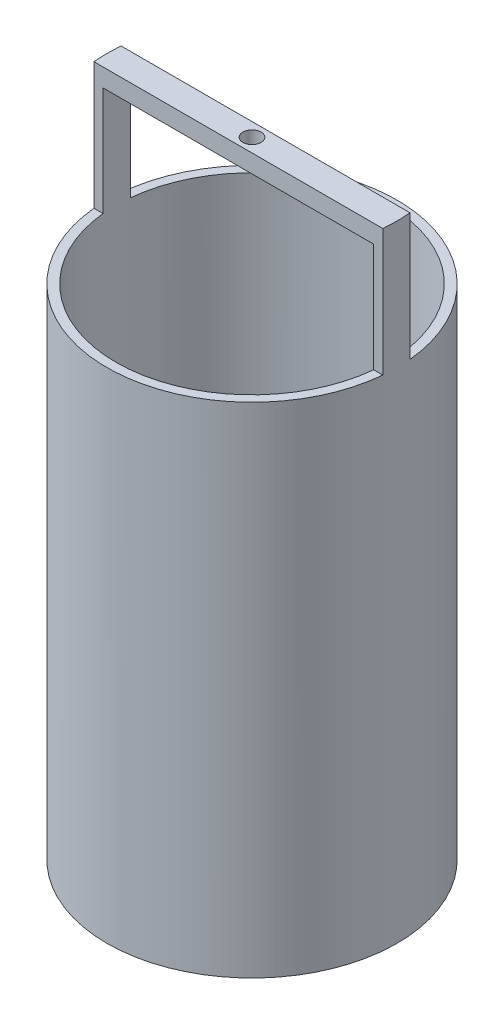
SolidWorks part; units mm, degrees
ref_plane "Front Plane" through (0, 0, 0) normal (0, 0, 1) x (1, 0, 0)
ref_plane "Top Plane" through (0, 0, 0) normal (0, 1, 0) x (1, 0, 0)
ref_plane "Right Plane" through (0, 0, 0) normal (1, 0, 0) x (0, 0, -1)
sketch "Sketch1" plane through (0, 0, 0) normal (0, 1, 0) x (1, 0, 0)
  circle A0 centre (0, 0) radius 160
  circle A1 centre (0, 0) radius 150
  dimension "D1" = 300
  dimension "D2" = 320
extrude "Boss-Extrude1" add sketch "Sketch1" along normal blind 550
sketch "Sketch2" plane through (0, 550, 0) normal (0, 1, 0) x (1, 0, 0)
  line L0 (0, -15) -> (0, 15) construction
  line L2 (0, -55) -> (0, 55) construction
  line L3 (-159.2953, 15) -> (-149.2481, 15)
  line L4 (-159.2953, -15) -> (-149.2481, -15)
  line L6 (149.2481, 15) -> (159.2953, 15)
  line L7 (149.2481, -15) -> (159.2953, -15)
  circle A0 centre (0, 0) radius 160 construction
  arc A1 (-159.2953, 15) -> (-159.2953, -15) centre (0, 0) ccw
  arc A2 (-149.2481, 15) -> (-149.2481, -15) centre (0, 0) ccw
  arc A3 (159.2953, -15) -> (159.2953, 15) centre (0, 0) ccw
  arc A4 (149.2481, -15) -> (149.2481, 15) centre (0, 0) ccw
  point P4 (0, 0)
  dimension "D2" = 300
  dimension "D1" = 30
extrude "Boss-Extrude2" add sketch "Sketch2" along normal blind 120
sketch "Sketch3" plane through (0, 670, 0) normal (0, 1, 0) x (1, 0, 0)
  line L0 (-159.2953, 15) -> (159.2953, 15)
  line L1 (-159.2953, -15) -> (159.2953, -15)
  arc A0 (159.2953, -15) -> (159.2953, 15) centre (0, 0) ccw construction
  arc A1 (-159.2953, 15) -> (-159.2953, -15) centre (0, 0) ccw construction
  arc A2 (159.2953, -15) -> (159.2953, 15) centre (0, 0) ccw
  arc A3 (-159.2953, 15) -> (-159.2953, -15) centre (0, 0) ccw
  circle A4 centre (0, 0) radius 10
  dimension "D1" = 20
extrude "Boss-Extrude3" add sketch "Sketch3" along normal blind 20
sketch "Sketch4" plane through (0, 0, 0) normal (1, 0, 0) x (0, 0, -1)
  line L0 (150, 0) -> (180, 0) construction
  line L1 (176, 0) -> (-176, 0) construction
  line L3 (180, 0) -> (180, 20) construction
  line L4 (180, 40) -> (150, 40)
  line L5 (150, 40) -> (150, 0)
  line L6 (150, 0) -> (180, 0)
  circle A0 centre (180, 20) radius 10
  arc A1 (180, 0) -> (180, 40) centre (180, 20) ccw
  dimension "D1" = 20
  dimension "D2" = 20
  dimension "D3" = 30
extrude "Boss-Extrude4" add sketch "Sketch4" along normal mid plane 40
